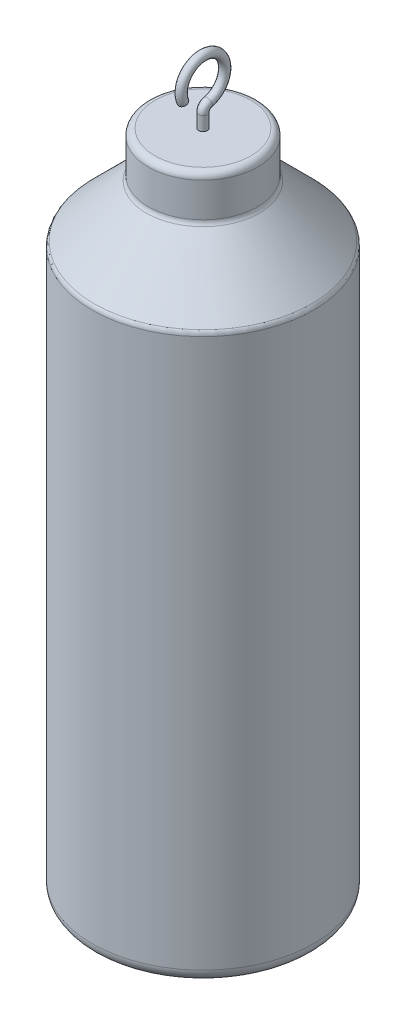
SolidWorks part; units mm, degrees
ref_plane "Спереди" through (0, 0, 0) normal (0, 0, 1) x (1, 0, 0)
ref_plane "Сверху" through (0, 0, 0) normal (0, 1, 0) x (1, 0, 0)
ref_plane "Справа" through (0, 0, 0) normal (1, 0, 0) x (0, 0, -1)
sketch "Эскиз1" plane through (0, 0, 0) normal (0, 0, 1) x (1, 0, 0)
  line L0 (0, 0) -> (0, 160.2379) construction
  line L1 (0, 0) -> (-25.4, 0)
  line L2 (-25.4, 0) -> (-25.4, 129.525)
  line L3 (-25.4, 129.525) -> (-12.525, 142.4)
  line L4 (-12.525, 142.4) -> (-12.525, 152.4)
  line L5 (-12.525, 152.4) -> (-1, 152.4)
  line L6 (-1, 152.4) -> (-1, 122.4)
  line L7 (-1, 122.4) -> (0, 121.7991)
  line L8 (0, 0) -> (0, 121.7991)
  dimension "D1" = 50.8
  dimension "D2" = 152.4
  dimension "D3" = 10
  dimension "D4" = 45
  dimension "D5" = 25.05
  dimension "D6" = 2
  dimension "D7" = 59
  dimension "D8" = 30
revolve "Повернуть1" add sketch "Эскиз1" angle 360 about L0
fillet "Скругление1" radius 1.5 3 edges at (0, 129.525, -25.4) (0, 142.4, -12.525) (0, 152.4, -12.525)
fillet "Скругление2" radius 3 1 edges at (0, 0, -25.4)
sketch "Эскиз2" plane through (0, 0, 0) normal (1, 0, 0) x (0, 0, -1)
  line L0 (0, 122.4) -> (0, 155.5754)
  line L1 (11.025, 152.4) -> (-11.025, 152.4) construction
  line L2 (0, 161.9) -> (-4.5315, 159.7869) construction
  line L3 (0, 161.9) -> (-5, 161.9) construction
  arc A0 (1.1538, 157.035) -> (-4.5315, 159.7869) centre (0, 161.9) ccw
  arc A1 (0, 155.5754) -> (1.1538, 157.035) centre (1.5, 155.5754) cw
  point P10 (0, 156.9)
  point P11 (0, 166.9)
  dimension "D2" = 10
  dimension "D5" = 1.5
  dimension "D1" = 30
  dimension "D3" = 4.5
  dimension "D4" = 25
ref_plane "Плоскость1" through (0, 122.4, 0) normal (0, 1, 0) x (-1, 0, 0)
sketch "Эскиз3" plane through (0, 122.4, 0) normal (0, 1, 0) x (-1, 0, 0)
  circle A0 centre (0, 0) radius 1
  dimension "D1" = 2
sweep "По траектории1" add profiles "Эскиз3" path "Эскиз2"
chamfer "Фаска1" distance 0.15 angle 45 2 edges at (0, 122.4, 1) (0, 160.2095, 3.6252)
